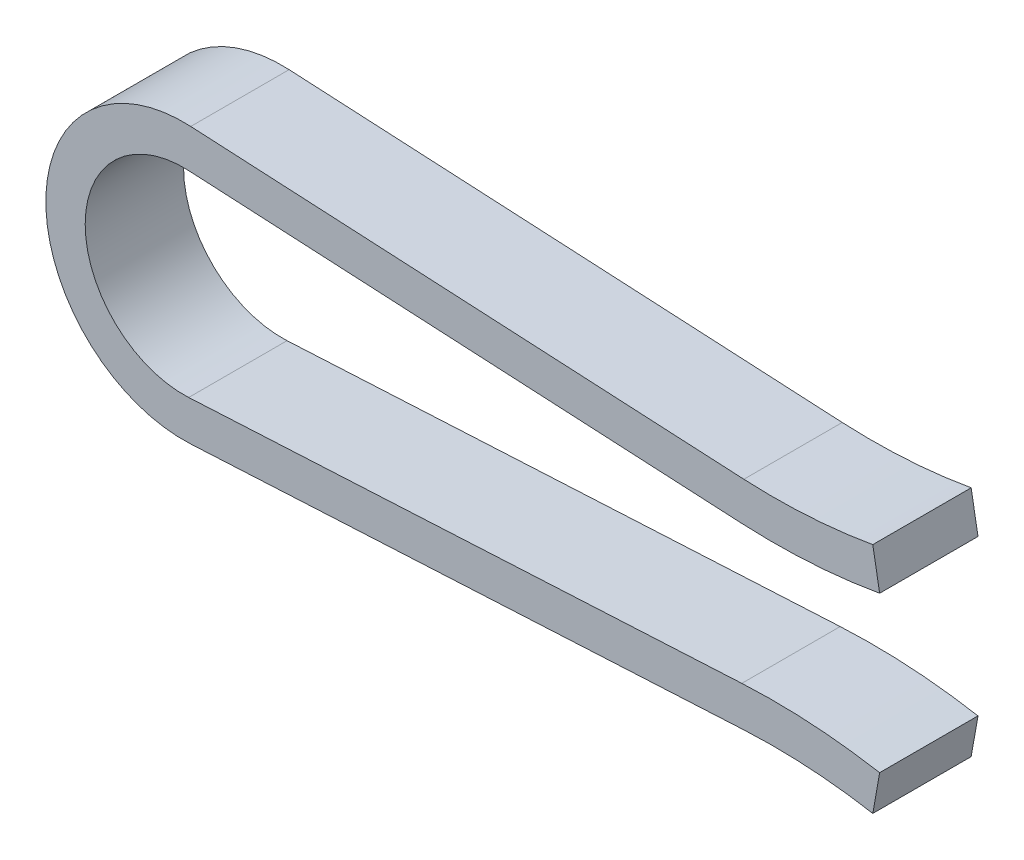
SolidWorks part; units mm, degrees
ref_plane "Front" through (0, 0, 0) normal (0, 0, 1) x (1, 0, 0)
ref_plane "Top" through (0, 0, 0) normal (0, 1, 0) x (1, 0, 0)
ref_plane "Right" through (0, 0, 0) normal (1, 0, 0) x (0, 0, -1)
sketch "Sketch1" plane through (0, 0, 0) normal (0, 0, 1) x (1, 0, 0)
  line L0 (0, 0) -> (44.5482, 0) construction
  line L1 (0.314, 5.9918) -> (28.4299, 4.5183)
  line L2 (0.314, -5.9918) -> (28.4299, -4.5183)
  line L4 (28.4299, 4.5183) -> (30, 34.4772) construction
  line L5 (30, 34.4772) -> (30, -14.4338) construction
  line L6 (30, 34.4772) -> (35.2094, 4.9329) construction
  arc A0 (0.314, 5.9918) -> (0.314, -5.9918) centre (0, 0) ccw
  arc A1 (28.4299, 4.5183) -> (35.2094, 4.9329) centre (30, 34.4772) ccw
  arc A2 (28.4299, -4.5183) -> (35.2094, -4.9329) centre (30, -34.4772) cw
  dimension "D1" = 12
  dimension "D2" = 30
  dimension "D3" = 3
  dimension "D4" = 10
  dimension "D5" = 30
ref_plane "Plane1" through (35.2094, -4.9329, 0) normal (0.9848, -0.1736, 0) x (0, 0, -1)
sketch "Sketch2" plane through (35.2094, -4.9329, 0) normal (0.9848, -0.1736, 0) x (0, 0, -1)
  line L1 (2.5, 1) -> (-2.5, 1)
  line L2 (2.5, 1) -> (2.5, -1)
  line L3 (2.5, -1) -> (-2.5, -1)
  line L4 (-2.5, 1) -> (-2.5, -1)
  line L5 (2.5, 1) -> (-2.5, -1) construction
  line L6 (2.5, -1) -> (-2.5, 1) construction
  point P0 (0, 0)
  dimension "D1" = 5
  dimension "D2" = 2
sweep "Sweep1" add profiles "Sketch2" path "Sketch1"
